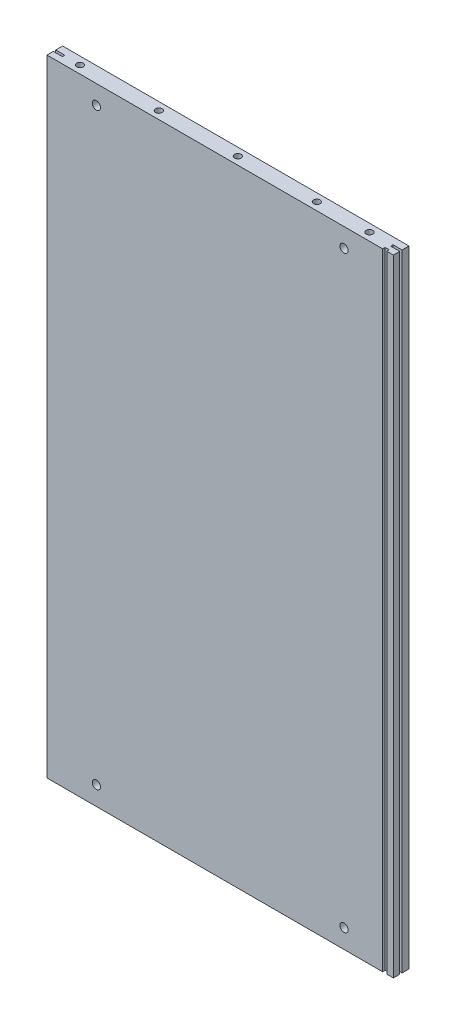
SolidWorks part; units mm, degrees
ref_plane "Ebene vorne" through (0, 0, 0) normal (0, 0, 1) x (1, 0, 0)
ref_plane "Ebene oben" through (0, 0, 0) normal (0, 1, 0) x (1, 0, 0)
ref_plane "Ebene rechts" through (0, 0, 0) normal (1, 0, 0) x (0, 0, -1)
sketch "Skizze1" plane through (0, 0, 0) normal (0, 0, 1) x (1, 0, 0)
  line L1 (-210.5, -380.5) -> (210.5, -380.5)
  line L2 (-210.5, -380.5) -> (-210.5, 380.5)
  line L3 (-210.5, 380.5) -> (210.5, 380.5)
  line L4 (210.5, -380.5) -> (210.5, 380.5)
  line L5 (-210.5, -380.5) -> (210.5, 380.5) construction
  line L6 (-210.5, 380.5) -> (210.5, -380.5) construction
  point P0 (0, 0)
  dimension "D1" = 421
  dimension "D2" = 761
extrude "Aufsatz-Linear austragen1" add sketch "Skizze1" along normal blind 19
sketch "Skizze3" plane through (0, -380.5, 0) normal (0, -1, 0) x (1, 0, 0)
  line L0 (197.5, 19) -> (197.5, 16)
  line L1 (-210.5, 19) -> (210.5, 19) construction
  line L2 (197.5, 16) -> (202.5, 16)
  line L3 (202.5, 16) -> (202.5, 19)
  line L4 (202.5, 19) -> (197.5, 19)
  line L5 (210.5, 19) -> (210.5, 0) construction
  dimension "D1" = 13
  dimension "D2" = 5
  dimension "D3" = 3
extrude "Schnitt-Linear austragen1" cut sketch "Skizze3" against normal through all
hole_wizard "Ø8.0 (8) Durchmesser Bohrung2" positions "Skizze8" profile "Skizze7" hole size "Ø8.0" standard "Din"
sketch "Skizze8" plane through (0, -380.5, 0) normal (0, -1, 0) x (1, 0, 0)
  line L0 (-210.5, 0) -> (210.5, 0) construction
  line L1 (210.5, 19) -> (210.5, 0) construction
  point P0 (172, 9.5)
  point P2 (108, 9.5)
  point P4 (12, 9.5)
  point P6 (-84, 9.5)
  point P8 (-180, 9.5)
  dimension "D1" = 9.5
  dimension "D2" = 38.5
  dimension "D3" = 64
  dimension "D4" = 96
  dimension "D5" = 96
  dimension "D6" = 96
sketch "Skizze7" plane through (172, -380.5, 9.5) normal (1, 0, 0) x (0, 0, -1)
  line L0 (0, 0) -> (0, 29.4034)
  line L1 (0, 29.4034) -> (4, 27)
  line L2 (4, 27) -> (4, 0)
  line L5 (4, 0) -> (0, 0)
  line L10 (0, 29.4034) -> (-4, 27) construction
  line L11 (0, -6.35) -> (0, 107.95) construction
  dimension "Bohrerdurchmesser" = 8
  dimension "Bohrungstiefe" = 27
  dimension "Spitzenwinkel" = 118
ref_plane "Ebene1" [suppressed] through (0, 0, 0) normal (0, 1, 0) x (-1, 0, 0)
mirror "Spiegeln1" about plane through (0, 0, 0) normal (0, 1, 0) of "Ø8.0 (8) Durchmesser Bohrung2"
hole_wizard "Ø10.0 (10) Durchmesser Bohrung1" positions "Skizze10" profile "Skizze9" hole size "Ø10.0" standard "Din"
sketch "Skizze10" plane through (0, 0, 19) normal (0, 0, 1) x (1, 0, 0)
  line L0 (197.5, 380.5) -> (-210.5, 380.5) construction
  line L1 (-210.5, 380.5) -> (-210.5, -380.5) construction
  line L2 (210.5, -380.5) -> (210.5, 380.5) construction
  line L3 (-210.5, -380.5) -> (197.5, -380.5) construction
  point P0 (-150.5, 357.5)
  point P2 (150.5, 357.5)
  point P4 (150.5, -357.5)
  point P6 (-150.5, -357.5)
  dimension "D1" = 23
  dimension "D2" = 60
  dimension "D3" = 60
  dimension "D4" = 23
sketch "Skizze9" plane through (-150.5, 357.5, 19) normal (1, 0, 0) x (0, -1, 0)
  line L0 (0, 0) -> (0, 19)
  line L1 (0, 19) -> (5, 19)
  line L2 (5, 19) -> (5, 0)
  line L5 (5, 0) -> (0, 0)
  line L11 (0, -6.35) -> (0, 107.95) construction
  dimension "Bohrerdurchmesser" = 10
  dimension "Bohrungstiefe" = 19
sketch "Skizze11" plane through (0, 380.5, 0) normal (0, 1, 0) x (1, 0, 0)
  line L0 (210.5, -11.3) -> (199.5, -11.3)
  line L2 (199.5, -11.3) -> (199.5, -8.4)
  line L3 (199.5, -8.4) -> (210.5, -8.4)
  line L4 (210.5, -8.4) -> (210.5, -11.3)
  line L6 (210.5, 0) -> (-210.5, 0) construction
  line L7 (0, 0) -> (0, -72.609) construction
  line L8 (-210.5, -8.4) -> (-210.5, -11.3)
  line L9 (-199.5, -8.4) -> (-210.5, -8.4)
  line L10 (-199.5, -11.3) -> (-199.5, -8.4)
  line L11 (-210.5, -11.3) -> (-199.5, -11.3)
  dimension "D1" = 2.9
  dimension "D2" = 11
  dimension "D3" = 8.4
extrude "Schnitt-Linear austragen2" cut sketch "Skizze11" against normal through all
